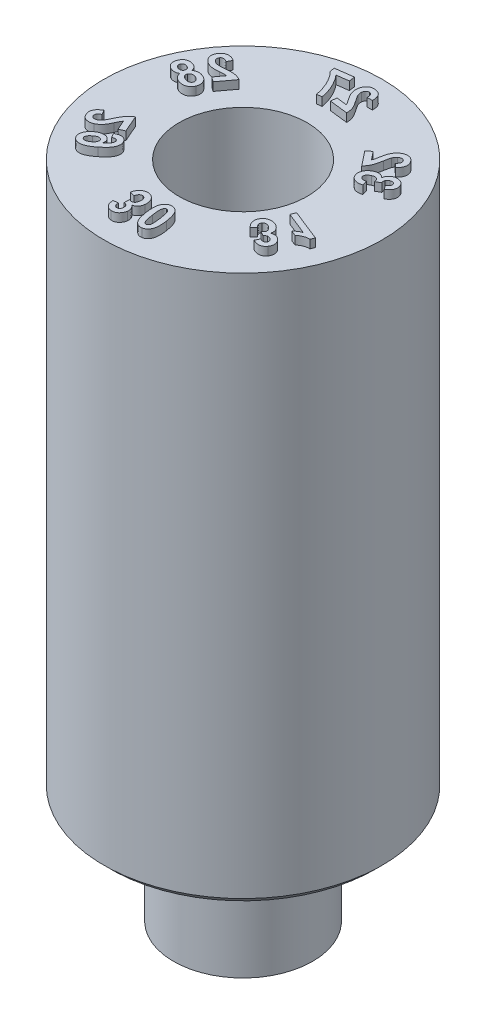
SolidWorks part; units mm, degrees
other "<M5L10-SetScrew>-<Chamfer1>" parameters "D10"=0.24
ref_plane "Front Plane" through (0, 0, 0) normal (0, 0, 1) x (1, 0, 0)
ref_plane "Top Plane" through (0, 0, 0) normal (0, 1, 0) x (1, 0, 0)
ref_plane "Right Plane" through (0, 0, 0) normal (1, 0, 0) x (0, 0, -1)
sketch "Sketch1" plane through (0, 0, 0) normal (0, 0, 1) x (1, 0, 0)
  line L0 (0, 0) -> (0, 20) construction
  line L1 (0, -5.5) -> (0, 5.5) construction
  line L2 (2.5, -19.7) -> (4.76, -19.7)
  line L4 (5, -19.46) -> (5, 0)
  line L5 (5, 0) -> (2.3, 0)
  line L6 (2.3, 0) -> (2.3, -4)
  line L7 (2.3, -4) -> (1.25, -4)
  line L8 (1.25, -4) -> (1.25, -13.7)
  line L9 (1.25, -13.7) -> (2.5, -13.7)
  line L10 (2.5, -13.7) -> (2.5, -19.7)
  line L11 (4.76, -19.7) -> (5, -19.46)
  point P6 (5, -19.7)
  dimension "D1" = 4
  dimension "D2" = 6
  dimension "D3" = 2.5
  dimension "D4" = 4.6
  dimension "D5" = 10
  dimension "D6" = 5
  dimension "D7" = 19.7
revolve "Revolve1" add sketch "Sketch1" angle 360 about L0
sketch "Sketch2" plane through (0, 0, 0) normal (0, 1, 0) x (1, 0, 0)
  line L0 (0, 0) -> (0, 4.1718) construction
  line L1 (0, 0) -> (3.6129, 2.0859) construction
  line L2 (0, 0) -> (3.6129, -2.0859) construction
  line L3 (0, 0) -> (0, -4.1718) construction
  line L4 (0, 0) -> (-3.6129, -2.0859) construction
  line L5 (0, 0) -> (-3.6129, 2.0859) construction
  arc A0 (0.74, 3.0104) -> (1.9384, 2.4192) centre (0, 0) ccw construction
  text T0 "27    28    29    30    31    32" font "Arial Narrow" height 1.2
  point P13 (0, 0)
  point P17 (0, 0)
  point P18 (0, 0)
  point P20 (0, 0)
  dimension "D1" = 6.2
  dimension "D2" = 6
extrude "Boss-Extrude1" add sketch "Sketch2" along normal blind 0.3
inserted part "M5L10-SetScrew"
move or copy body "Body-Move/Copy2" placed by mates yes
other "Distance1" parameters "D1"=4
